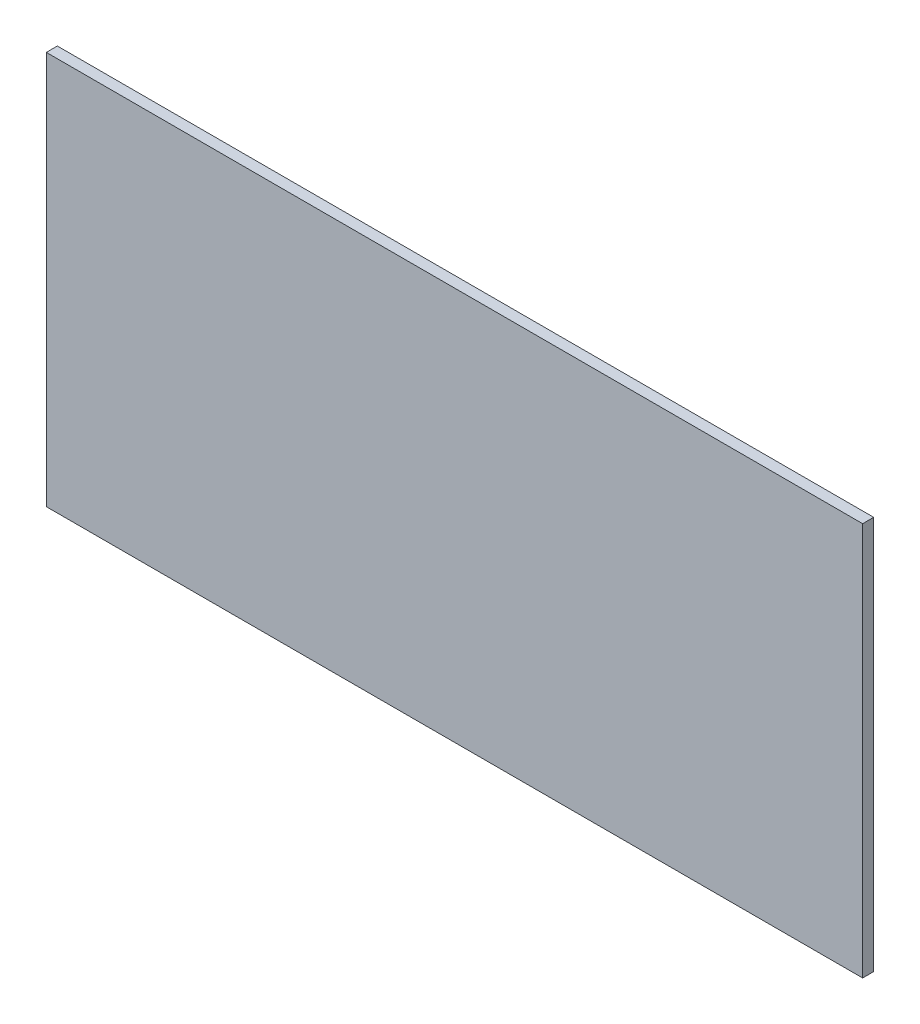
SolidWorks part; units mm, degrees
ref_plane "Plan de face" through (0, 0, 0) normal (0, 0, 1) x (1, 0, 0)
ref_plane "Plan de dessus" through (0, 0, 0) normal (0, 1, 0) x (1, 0, 0)
ref_plane "Plan de droite" through (0, 0, 0) normal (1, 0, 0) x (0, 0, -1)
sketch "Esquisse1" plane through (0, 0, 0) normal (0, 0, 1) x (1, 0, 0)
  line L1 (0, 0) -> (222, 0)
  line L2 (0, 0) -> (0, 107)
  line L3 (0, 107) -> (222, 107)
  line L4 (222, 0) -> (222, 107)
  dimension "D1" = 222
  dimension "D2" = 107
extrude "Extrusion1" add sketch "Esquisse1" along normal blind 3
